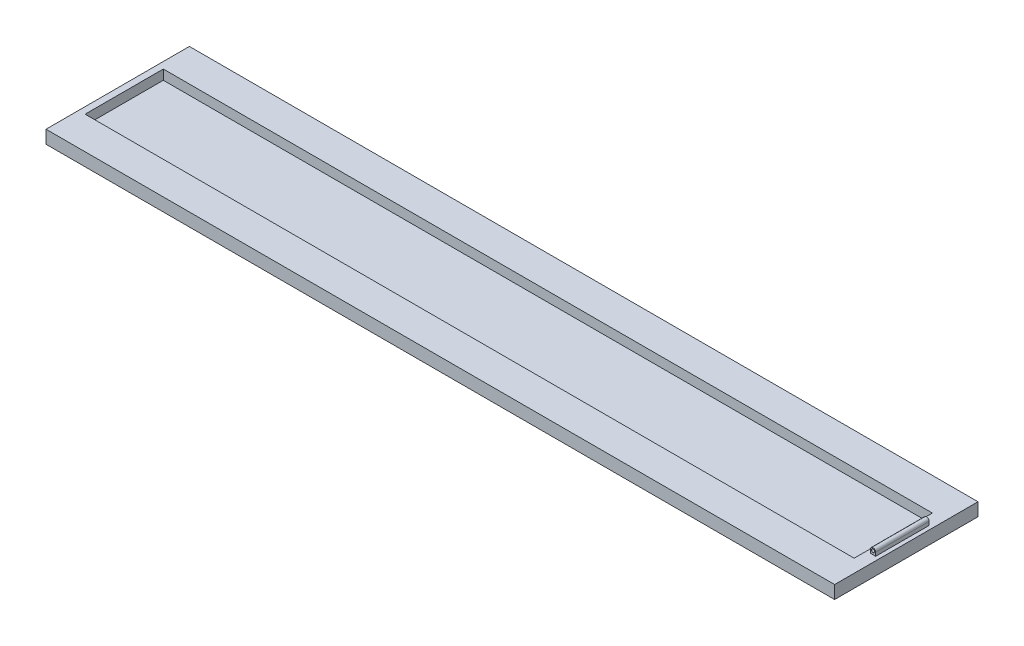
SolidWorks part; units mm, degrees
ref_plane "Face" through (0, 0, 0) normal (0, 0, 1) x (1, 0, 0)
ref_plane "Dessus" through (0, 0, 0) normal (0, 1, 0) x (1, 0, 0)
ref_plane "Droite" through (0, 0, 0) normal (1, 0, 0) x (0, 0, -1)
sketch "Esquisse1" plane through (0, 0, 0) normal (0, 0, 1) x (1, 0, 0)
  line L1 (-12000, -55) -> (100, -55)
  line L2 (-12000, -55) -> (-12000, -255)
  line L3 (-12000, -255) -> (100, -255)
  line L4 (100, -55) -> (100, -255)
  dimension "D1" = 12100
  dimension "D2" = 100
  dimension "D3" = 55
  dimension "D4" = 200
extrude "Extrusion1" add sketch "Esquisse1" along normal mid plane 2200
sketch "Esquisse2" plane through (0, 0, 0) normal (0, 0, 1) x (1, 0, 0)
  line L0 (-40, 0) -> (-40, -55)
  line L1 (100, -55) -> (-12000, -55) construction
  line L2 (-40, -55) -> (40, -55)
  line L3 (40, -55) -> (40, 0)
  circle A0 centre (0, 0) radius 25
  arc A1 (40, 0) -> (-40, 0) centre (0, 0) ccw
  dimension "D1" = 50
  dimension "D2" = 80
extrude "Extrusion2" add sketch "Esquisse2" along normal mid plane 820
sketch "Esquisse3" plane through (0, -55, 0) normal (0, 1, 0) x (1, 0, 0)
  line L0 (100, 1100) -> (-12000, 1100) construction
  line L1 (-11900, 600) -> (-100, 600)
  line L2 (-11900, 600) -> (-11900, -600)
  line L3 (-11900, -600) -> (-100, -600)
  line L4 (-100, 600) -> (-100, -600)
  line L5 (100, -1100) -> (100, 1100) construction
  line L6 (100, -1100) -> (-12000, -1100) construction
  line L7 (-12000, -1100) -> (-12000, 1100) construction
  dimension "D1" = 500
  dimension "D2" = 200
  dimension "D3" = 500
  dimension "D4" = 100
extrude "Enlèv. mat.-Extru.1" cut sketch "Esquisse3" against normal blind 150
